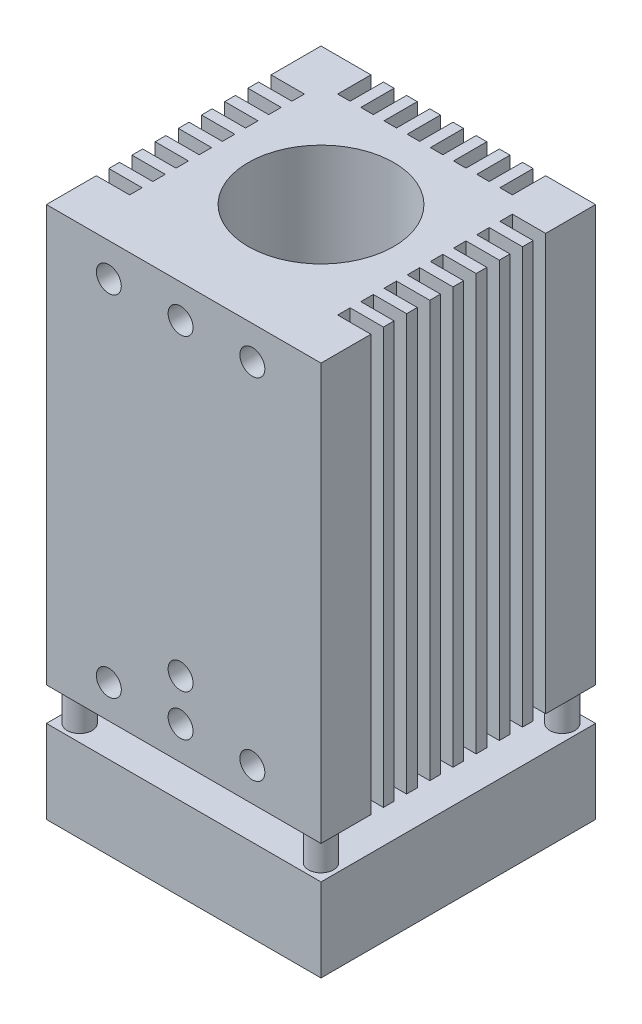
SolidWorks part; units mm, degrees
ref_plane "Спереди" through (0, 0, 0) normal (0, 0, 1) x (1, 0, 0)
ref_plane "Сверху" through (0, 0, 0) normal (0, 1, 0) x (1, 0, 0)
ref_plane "Справа" through (0, 0, 0) normal (1, 0, 0) x (0, 0, -1)
sketch "Эскиз1" plane through (0, 0, 0) normal (0, 0, 1) x (1, 0, 0)
  line L1 (0, 0) -> (33, 0)
  line L2 (0, 0) -> (0, 50)
  line L3 (0, 50) -> (33, 50)
  line L4 (33, 0) -> (33, 50)
  dimension "D1" = 33
  dimension "D2" = 50
extrude "Бобышка-Вытянуть1" add sketch "Эскиз1" along normal blind 33
sketch "Эскиз2" plane through (0, 50, 0) normal (0, 1, 0) x (1, 0, 0)
  line L0 (33, 0) -> (0, 0) construction
  line L1 (6, 0) -> (7.5, 0)
  line L2 (6, 0) -> (6, -4)
  line L3 (6, -4) -> (7.5, -4)
  line L4 (7.5, 0) -> (7.5, -4)
  dimension "D1" = 6
  dimension "D2" = 1.5
  dimension "D3" = 4
extrude "Вырез-Вытянуть1" cut sketch "Эскиз2" against normal through all
sketch "Эскиз3" plane through (0, 50, 0) normal (0, 1, 0) x (1, 0, 0)
  line L0 (6, -4) -> (26.25, -4) construction
  line L1 (33, -33) -> (33, 0) construction
  dimension "D1" = 6.75
pattern_curve "Кривая1" of "Вырез-Вытянуть1" parameters "D1"=8, "D3"=50, "D2"=1, "D4"=50
sketch "Эскиз4" plane through (0, 50, 0) normal (0, 1, 0) x (1, 0, 0)
  line L0 (0, -33) -> (0, 0) construction
  line L1 (0, -6) -> (4, -6)
  line L2 (0, -6) -> (0, -7.5)
  line L3 (0, -7.5) -> (4, -7.5)
  line L4 (4, -6) -> (4, -7.5)
  line L5 (33, -33) -> (33, 0) construction
  line L6 (33, -6) -> (29, -6)
  line L7 (33, -6) -> (33, -7.5)
  line L8 (33, -7.5) -> (29, -7.5)
  line L9 (29, -6) -> (29, -7.5)
  line L10 (6, 0) -> (0, 0) construction
  line L11 (33, 0) -> (27, 0) construction
  dimension "D1" = 1.5
  dimension "D2" = 4
  dimension "D3" = 6
  dimension "D4" = 4
  dimension "D5" = 6
  dimension "D6" = 1.5
extrude "Вырез-Вытянуть2" cut sketch "Эскиз4" against normal through all
sketch "Эскиз5" plane through (0, 50, 0) normal (0, 1, 0) x (1, 0, 0)
  line L0 (4, -6) -> (4, -26.25) construction
  line L1 (33, -33) -> (0, -33) construction
  dimension "D1" = 6.75
pattern_curve "Кривая2" of "Вырез-Вытянуть2" parameters "D1"=8, "D3"=50, "D2"=1, "D4"=50
sketch "Эскиз6" plane through (0, 50, 0) normal (0, 1, 0) x (1, 0, 0)
  circle A0 centre (16.5, -16.5) radius 8.75
  dimension "D1" = 17.5
  dimension "D2" = 16.5
  dimension "D3" = 16.5
extrude "Вырез-Вытянуть3" cut sketch "Эскиз6" against normal blind 33
sketch "Эскиз7" plane through (0, 0, 33) normal (0, 0, 1) x (1, 0, 0)
  line L0 (6, 50) -> (26.25, 50) construction
  line L1 (0, 50) -> (0, 0) construction
  line L2 (16.125, 50) -> (16.125, 51.2164) construction
  line L3 (0, 25) -> (20.3852, 25) construction
  line L4 (16.125, 0) -> (16.125, -1.2164) construction
  circle A0 centre (7.5, 46) radius 1.5
  circle A1 centre (16.125, 46) radius 1.5
  circle A2 centre (24.75, 46) radius 1.5
  circle A3 centre (24.75, 4) radius 1.5
  circle A4 centre (16.125, 4) radius 1.5
  circle A5 centre (7.5, 4) radius 1.5
  circle A6 centre (16.125, 9) radius 1.5
  dimension "D1" = 3
  dimension "D2" = 4
  dimension "D3" = 7.5
  dimension "D4" = 5
extrude "Вырез-Вытянуть4" cut sketch "Эскиз7" against normal blind 5
sketch "Эскиз8" plane through (0, 0, 33) normal (0, 0, 1) x (1, 0, 0)
  line L0 (0, 0) -> (33, 0) construction
  line L1 (0, -4) -> (33, -4)
  line L2 (0, -4) -> (0, -14)
  line L3 (0, -14) -> (33, -14)
  line L4 (33, -4) -> (33, -14)
  dimension "D1" = 4
  dimension "D2" = 10
extrude "Бобышка-Вытянуть2" add sketch "Эскиз8" against normal up to surface (33 mm away) separate body
sketch "Эскиз9" plane through (0, -4, 0) normal (0, 1, 0) x (1, 0, 0)
  line L0 (0, 0) -> (0, -33) construction
  line L1 (0, -33) -> (33, -33) construction
  line L2 (33, 0) -> (33, -33) construction
  line L3 (0, 0) -> (33, 0) construction
  circle A0 centre (2, -31) radius 1.5
  circle A1 centre (31, -31) radius 1.5
  circle A2 centre (31, -2) radius 1.5
  circle A3 centre (2, -2) radius 1.5
  dimension "D1" = 3
  dimension "D2" = 2
  dimension "D3" = 2
  dimension "D4" = 2
  dimension "D5" = 2
extrude "Бобышка-Вытянуть3" add sketch "Эскиз9" along normal up to surface (4 mm away)
